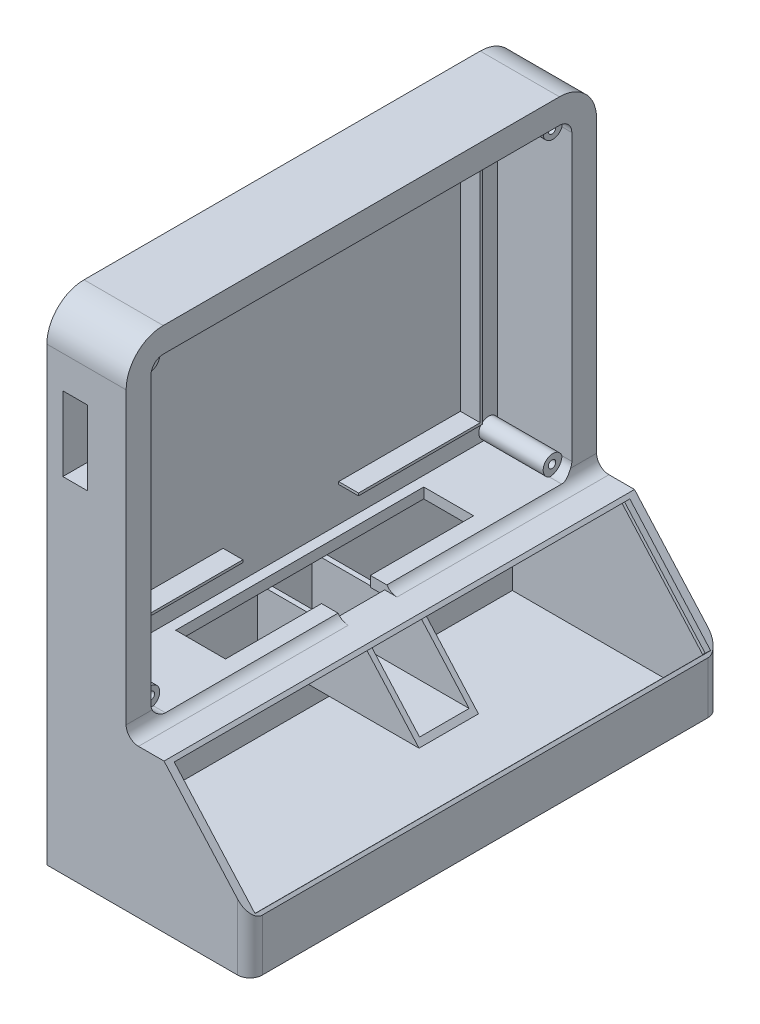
SolidWorks part; units mm, degrees
ref_plane "Front Plane" through (0, 0, 0) normal (0, 0, 1) x (1, 0, 0)
ref_plane "Top Plane" through (0, 0, 0) normal (0, 1, 0) x (1, 0, 0)
ref_plane "Right Plane" through (0, 0, 0) normal (1, 0, 0) x (0, 0, -1)
sketch "Sketch1" plane through (0, 0, 0) normal (1, 0, 0) x (0, 0, -1)
  line L0 (-80, 72.5) -> (80, 72.5)
  line L1 (-80, 62.5) -> (80, 62.5)
  line L2 (-85, 57.5) -> (-85, -57.5)
  line L3 (-80, -62.5) -> (80, -62.5)
  line L4 (85, 57.5) -> (85, -57.5)
  line L5 (-85, 62.5) -> (85, -62.5) construction
  line L6 (-85, -62.5) -> (85, 62.5) construction
  line L7 (95, 57.5) -> (95, -57.5)
  line L8 (-80, -72.5) -> (80, -72.5)
  line L9 (-95, 57.5) -> (-95, -57.5)
  line L14 (0, 58.5) -> (0, 50.7963) construction
  line L15 (-81, 0) -> (-77.1914, 0) construction
  line L16 (79.5, 58.5) -> (79.56, 58.5)
  arc A0 (80, 62.5) -> (85, 57.5) centre (80, 57.5) cw
  arc A1 (80, -62.5) -> (85, -57.5) centre (80, -57.5) ccw
  arc A2 (-85, -57.5) -> (-80, -62.5) centre (-80, -57.5) ccw
  arc A3 (-80, 62.5) -> (-85, 57.5) centre (-80, 57.5) ccw
  arc A4 (80, 72.5) -> (95, 57.5) centre (80, 57.5) cw
  arc A5 (80, -72.5) -> (95, -57.5) centre (80, -57.5) ccw
  arc A6 (-95, -57.5) -> (-80, -72.5) centre (-80, -57.5) ccw
  arc A7 (-80, 72.5) -> (-95, 57.5) centre (-80, 57.5) ccw
  circle A12 centre (-81, 58.5) radius 1.5
  circle A13 centre (81, 58.5) radius 1.5
  circle A14 centre (81, -58.5) radius 1.5
  circle A15 centre (-81, -58.5) radius 1.5
  arc A16 (-85, 57.5) -> (-80, 62.5) centre (-81.3311, 58.8311) ccw
  arc A17 (85, 57.5) -> (80, 62.5) centre (81.3311, 58.8311) cw
  arc A18 (85, -57.5) -> (80, -62.5) centre (81.3311, -58.8311) ccw
  arc A19 (-85, -57.5) -> (-80, -62.5) centre (-81.3311, -58.8311) cw
  point P0 (0, 0)
  point P30 (-81, 57.5)
  point P31 (-81, -57.5)
  point P33 (-80, -58.5)
  point P34 (80, -58.5)
  point P36 (81, -57.5)
  point P37 (81, 57.5)
  point P39 (80, 58.5)
  point P40 (-80, 58.5)
  dimension "D3" = 5
  dimension "D6" = 3
  dimension "D1" = 170
  dimension "D2" = 125
  dimension "D4" = 10
extrude "Boss-Extrude1" add sketch "Sketch1" along normal blind 30 contours L0 A7 L9 A6 L8 A5 L7 A4 A3 L1 A0 L4 A1 L3 A2 L2 | A3 A16 A12 | A19 A2 A15 | A17 A0 A13 | A1 A18 A14
sketch "Sketch2" plane through (30, 0, 0) normal (1, 0, 0) x (0, 0, -1)
  line L0 (-80, 62.5) -> (80, 62.5) construction
  line L1 (-80, 62.5) -> (80, 62.5)
  line L2 (85, 57.5) -> (85, -57.5) construction
  line L3 (-80, -62.5) -> (80, -62.5) construction
  line L4 (-85, 57.5) -> (-85, -57.5) construction
  line L5 (85, 57.5) -> (85, -57.5)
  line L6 (-80, -62.5) -> (80, -62.5)
  line L7 (-85, 57.5) -> (-85, -57.5)
  arc A0 (80, 62.5) -> (85, 57.5) centre (80, 57.5) cw
  arc A1 (-85, 57.5) -> (-80, 62.5) centre (-80, 57.5) cw
  arc A2 (-85, -57.5) -> (-80, -62.5) centre (-80, -57.5) ccw
  arc A3 (80, -62.5) -> (85, -57.5) centre (80, -57.5) ccw
extrude "Cut-Extrude1" cut sketch "Sketch2" against normal blind 4
sketch "Sketch3" plane through (0, 0, 0) normal (-1, 0, 0) x (0, 0, 1)
  line L0 (-95, 57.5) -> (-95, -57.5) construction
  line L1 (80, -72.5) -> (-80, -72.5) construction
  line L2 (95, 57.5) -> (95, -57.5) construction
  line L3 (80, 72.5) -> (-80, 72.5) construction
  line L4 (-95, 57.5) -> (-95, -57.5)
  line L5 (80, -72.5) -> (-80, -72.5)
  line L6 (95, 57.5) -> (95, -57.5)
  line L7 (80, 72.5) -> (-80, 72.5)
  arc A0 (-95, -57.5) -> (-80, -72.5) centre (-80, -57.5) ccw construction
  arc A1 (80, -72.5) -> (95, -57.5) centre (80, -57.5) ccw construction
  arc A2 (95, 57.5) -> (80, 72.5) centre (80, 57.5) ccw construction
  arc A3 (-80, 72.5) -> (-95, 57.5) centre (-80, 57.5) ccw construction
  arc A4 (-95, -57.5) -> (-80, -72.5) centre (-80, -57.5) ccw
  arc A5 (80, -72.5) -> (95, -57.5) centre (80, -57.5) ccw
  arc A6 (95, 57.5) -> (80, 72.5) centre (80, 57.5) ccw
  arc A7 (-80, 72.5) -> (-95, 57.5) centre (-80, 57.5) ccw
extrude "Boss-Extrude3" add sketch "Sketch3" along normal blind 2
sketch "Sketch8" plane through (-2, 0, 0) normal (-1, 0, 0) x (0, 0, 1)
  line L0 (-95, -57.5) -> (-95, -124.675)
  line L1 (-95, -124.675) -> (95, -124.675)
  line L2 (95, -57.5) -> (95, -124.675)
  line L3 (-80, -72.5) -> (80, -72.5)
  arc A0 (-95, -57.5) -> (-80, -72.5) centre (-80, -57.5) ccw
  arc A1 (80, -72.5) -> (95, -57.5) centre (80, -57.5) ccw
extrude "Boss-Extrude6" add sketch "Sketch8" against normal up to surface (32 mm away)
sketch "Sketch10" plane through (0, 0, 95) normal (0, 0, 1) x (1, 0, 0)
  line L0 (30, -124.675) -> (80, -124.675)
  line L1 (80, -124.675) -> (80, -101.7532)
  line L3 (48.8255, -66.675) -> (30, -66.675)
  line L4 (30, 57.5) -> (30, -124.675) construction
  line L5 (80, -101.7532) -> (48.8255, -66.675)
  line L9 (30, 57.5) -> (-2, 57.5)
  line L10 (-2, 57.5) -> (-2, -124.675)
  line L11 (-2, -124.675) -> (30, -124.675)
  line L12 (30, -124.675) -> (30, 57.5)
  line L16 (30, -124.675) -> (30, -66.675)
  dimension "D1" = 50
  dimension "D4" = 58
  dimension "D3" = 0
extrude "Boss-Extrude8" add sketch "Sketch10" against normal up to surface (190 mm away)
sketch "Sketch12" plane through (80, 0, 0) normal (1, 0, 0) x (0, 0, -1)
  line L4 (95, -66.675) -> (-95, -66.675) construction
  line L7 (-91, -66.675) -> (91, -66.675)
  line L8 (-91, -120.675) -> (91, -120.675)
  line L9 (91, -120.675) -> (91, -105.7532)
  line L10 (91, -105.7532) -> (-91, -105.7532)
  line L11 (-91, -105.7532) -> (-91, -120.675)
  line L12 (-91, -120.675) -> (91, -120.675)
  line L17 (-91, -66.675) -> (-91, -120.675)
  line L18 (91, -66.675) -> (91, -120.675)
  dimension "D1" = 4
extrude "Cut-Extrude5" cut sketch "Sketch12" against normal up to surface (80 mm away)
sketch "Sketch14" plane through (0, 0, -91) normal (0, 0, 1) x (1, 0, 0)
  line L0 (0, -120.675) -> (80, -120.675) construction
  line L1 (80, -101.7532) -> (78.4, -101.7532)
  line L2 (80, -101.7532) -> (80, -120.675)
  line L3 (80, -120.675) -> (78.4, -120.675)
  line L4 (78.4, -101.7532) -> (78.4, -120.675)
  dimension "D1" = 1.6
extrude "Boss-Extrude13" add sketch "Sketch14" along normal up to surface (182 mm away)
sketch "Sketch17" plane through (0, 0, 0) normal (1, 0, 0) x (0, 0, -1)
  line L0 (-71, 48.5) -> (-71, -48.5)
  line L1 (-70, 47.5) -> (70, 47.5)
  line L2 (-70, 47.5) -> (-70, -47.5)
  line L3 (-70, -47.5) -> (70, -47.5)
  line L4 (70, 47.5) -> (70, -47.5)
  line L5 (-70, 47.5) -> (70, -47.5) construction
  line L6 (-70, -47.5) -> (70, 47.5) construction
  line L7 (-71, -48.5) -> (71, -48.5)
  line L8 (71, 48.5) -> (71, -48.5)
  line L9 (-71, 48.5) -> (71, 48.5)
  point P0 (0, 0)
  dimension "D1" = 95
  dimension "D2" = 140
  dimension "D3" = 1
sketch "Sketch19" plane through (30, 0, 0) normal (1, 0, 0) x (0, 0, -1)
  line L0 (95, 57.5) -> (95, -66.675) construction
  line L1 (-95, -66.675) -> (95, -66.675)
  line L2 (-95, -66.675) -> (-95, -64.675)
  line L3 (-95, -64.675) -> (95, -64.675)
  line L4 (95, -66.675) -> (95, -64.675)
  dimension "D1" = 2
extrude "Boss-Extrude16" add sketch "Sketch19" along normal blind 19
sketch "Sketch20" plane through (0, 0, 95) normal (0, 0, 1) x (1, 0, 0)
  line L0 (80, -103.7032) -> (45.3122, -64.675)
  line L1 (80, -124.675) -> (80, -101.7532) construction
  line L2 (49, -64.675) -> (30, -64.675) construction
  line L3 (45.3122, -64.675) -> (50.2172, -60.3155)
  line L4 (50.2172, -60.3155) -> (84.905, -99.3437)
  line L5 (84.905, -99.3437) -> (80, -103.7032)
extrude "Cut-Extrude6" cut sketch "Sketch20" against normal through all
sketch "Sketch22" plane through (-6.7991, -6.043, 0) normal (0.7474, 0.6643, 0) x (0, 0, -1)
  line L8 (-92, -129.2499) -> (92, -129.2499)
  line L9 (92, -129.2499) -> (92, -80.1188)
  line L10 (92, -80.1188) -> (-92, -80.1188)
  line L11 (-92, -80.1188) -> (-92, -129.2499)
  line L12 (-92, -129.2499) -> (92, -129.2499)
  line L13 (92, -129.2499) -> (92, -80.1188)
  line L14 (92, -80.1188) -> (-92, -80.1188)
  line L15 (-92, -80.1188) -> (-92, -129.2499)
  dimension "D1" = 1
extrude "Cut-Extrude7" cut sketch "Sketch22" against normal blind 3
sketch "Sketch25" plane through (0, -62.5, 0) normal (0, 1, 0) x (1, 0, 0)
  line L1 (4.0626, 51.1392) -> (24.2045, 51.1392)
  line L2 (4.0626, 51.1392) -> (4.0626, -49.0656)
  line L3 (4.0626, -49.0656) -> (24.2045, -49.0656)
  line L4 (24.2045, 51.1392) -> (24.2045, -49.0656)
extrude "Cut-Extrude8" cut sketch "Sketch25" against normal blind 20
sketch "Sketch26" plane through (0, 0, 0) normal (1, 0, 0) x (0, 0, -1)
  line L0 (0, -66.675) -> (0, -89.675) construction
  line L1 (91, -66.675) -> (-91, -66.675) construction
  line L2 (0, -66.675) -> (-10, -66.675)
  line L3 (91, -66.675) -> (-91, -66.675) construction
  line L4 (-10, -66.675) -> (-10, -89.675)
  line L5 (-10, -89.675) -> (10, -89.675)
  line L6 (10, -89.675) -> (10, -66.675)
  line L7 (10, -66.675) -> (0, -66.675)
  line L8 (-12, -66.675) -> (-12, -91.675)
  line L9 (-12, -91.675) -> (12, -91.675)
  line L10 (12, -91.675) -> (12, -66.675)
  line L11 (-12, -66.675) -> (-10, -66.675)
  line L12 (10, -66.675) -> (12, -66.675)
  dimension "D1" = 10
  dimension "D2" = 10
  dimension "D3" = 23
  dimension "D4" = 2
extrude "Boss-Extrude18" add sketch "Sketch26" along normal up to surface (43.0761 mm away) contours L9 L10 L6 L5 L4 L8 M7
sketch "Sketch27" plane through (0, -62.5, 0) normal (0, 1, 0) x (1, 0, 0)
  line L0 (23.9727, 9.4307) -> (30, 9.4307)
  line L1 (30, -80) -> (30, 80) construction
  line L2 (30, 9.4307) -> (30, -10.2892)
  line L3 (30, -10.2892) -> (24.2045, -10.2892)
  line L4 (24.2045, -49.0656) -> (24.2045, 51.1392) construction
  line L5 (24.2045, -10.2892) -> (23.9727, 9.4307)
extrude "Cut-Extrude9" cut sketch "Sketch27" against normal blind 13
fillet "Fillet1" radius 5 4 edges at (30, -64.675, -52.2153) (30, -64.675, 52.6446) (80, -114.1891, 95) (80, -114.1891, -95)
extrude "Boss-Extrude19" add sketch "Sketch17" along normal blind 8
sketch "Sketch28" plane through (0, 0, 70) normal (0, 0, -1) x (-1, 0, 0)
  line L0 (-8, 47.5) -> (-8, -47.5) construction
  line L1 (-8, 41.0342) -> (0, 41.0342)
  line L2 (-8, 41.0342) -> (-8, 7.1393)
  line L3 (-8, 7.1393) -> (0, 7.1393)
  line L4 (0, 41.0342) -> (0, 7.1393)
  line L5 (0, 47.5) -> (0, -47.5) construction
extrude "Cut-Extrude10" cut sketch "Sketch28" against normal blind 8
sketch "Sketch29" plane through (0, -47.5, 0) normal (0, 1, 0) x (1, 0, 0)
  line L0 (8, -70) -> (8, 70) construction
  line L1 (8, -25.8406) -> (0, -25.8406)
  line L2 (8, -25.8406) -> (8, 20.8455)
  line L3 (8, 20.8455) -> (0, 20.8455)
  line L4 (0, -25.8406) -> (0, 20.8455)
  line L5 (0, -70) -> (0, 70) construction
extrude "Cut-Extrude11" cut sketch "Sketch29" against normal blind 8
sketch "Sketch30" plane through (0, 0, 95) normal (0, 0, 1) x (1, 0, 0)
  line L1 (4.4413, 44.3957) -> (14.4413, 44.3957)
  line L2 (4.4413, 44.3957) -> (4.4413, 14.3957)
  line L3 (4.4413, 14.3957) -> (14.4413, 14.3957)
  line L4 (14.4413, 44.3957) -> (14.4413, 14.3957)
  dimension "D1" = 10
  dimension "D2" = 30
extrude "Cut-Extrude12" cut sketch "Sketch30" against normal blind 17
